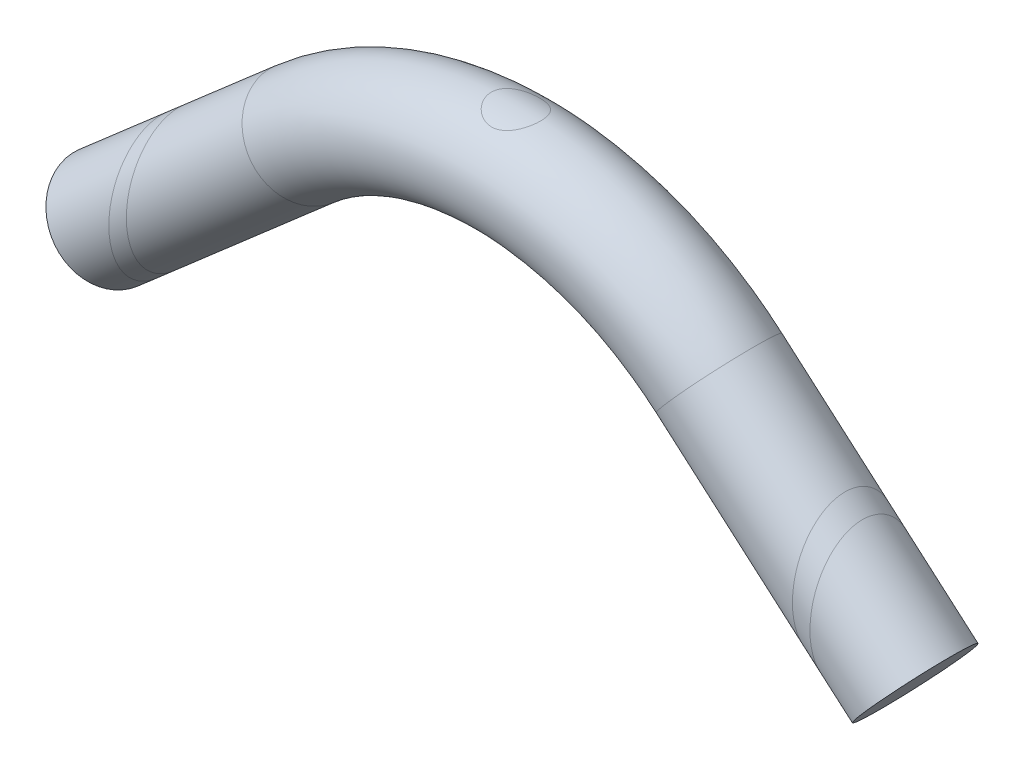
SolidWorks part; units mm, degrees
ref_plane "Front Plane" through (0, 0, 0) normal (0, 0, 1) x (1, 0, 0)
ref_plane "Top Plane" through (0, 0, 0) normal (0, 1, 0) x (1, 0, 0)
ref_plane "Right Plane" through (0, 0, 0) normal (1, 0, 0) x (0, 0, -1)
sketch "Sketch1" plane through (0, 0, 0) normal (0, 0, 1) x (1, 0, 0)
  line L0 (0, 0) -> (230, 0) construction
  line L1 (115, 0) -> (115, 70) construction
  line L2 (115, 70) -> (115, 100) construction
  line L3 (0, 0) -> (55.9439, 48.6469)
  line L4 (230, 0) -> (174.0561, 48.6469)
  arc A0 (174.0561, 48.6469) -> (55.9439, 48.6469) centre (115, -19.2676) ccw
  point P9 (115, 70.7324)
  dimension "D2" = 70
  dimension "D4" = 90
  dimension "D1" = 230
  dimension "D3" = 30
ref_plane "Plane1" through (115, 0, 0) normal (1, 0, 0) x (0, 0, -1)
ref_plane "Plane2" through (15, 0, 0) normal (1, 0, 0) x (0, 0, -1)
ref_plane "Plane4" through (210, 0, 0) normal (1, 0, 0) x (0, 0, -1)
ref_plane "Plane3" through (215, 0, 0) normal (1, 0, 0) x (0, 0, -1)
ref_plane "Plane5" through (20, 0, 0) normal (1, 0, 0) x (0, 0, -1)
sketch "Sketch3" plane through (115, 0, 0) normal (1, 0, 0) x (0, 0, -1)
  circle A0 centre (0, 70.7324) radius 15
sweep "Sweep1" add profiles "Sketch3" path "Sketch1"
mirror "Mirror1" about plane through (115, 0, 0) normal (1, 0, 0) of "Sweep1"
sketch "Sketch6" plane through (115, 0, 0) normal (1, 0, 0) x (0, 0, -1)
  line L0 (0, 176.1177) -> (0, 0.3524)
  line L1 (0, 0.3524) -> (-47.0962, 176.1177)
  dimension "D1" = 15
sketch "Sketch4" plane through (0, 0, 0) normal (0, 1, 0) x (1, 0, 0)
  circle A0 centre (116.1146, 0) radius 7
sketch "Sketch5" plane through (0, 0, 0) normal (0, 0, 1) x (1, 0, 0)
  line L0 (0, 0) -> (232.0005, 0) construction
ref_plane "Plane6" through (0, 0, 0) normal (0, -0.2588, 0.9659) x (1, 0, 0)
sketch "Sketch7" plane through (115, 0, 0) normal (1, 0, 0) x (0, 0, -1)
  line L0 (0, 55.7324) -> (0, 0) construction
  line L1 (0, 55.7324) -> (13.7485, 4.4223)
  arc A0 (-6.9106, 57.4191) -> (6.9107, 57.4191) centre (0, 70.7324) ccw construction
  dimension "D1" = 15
